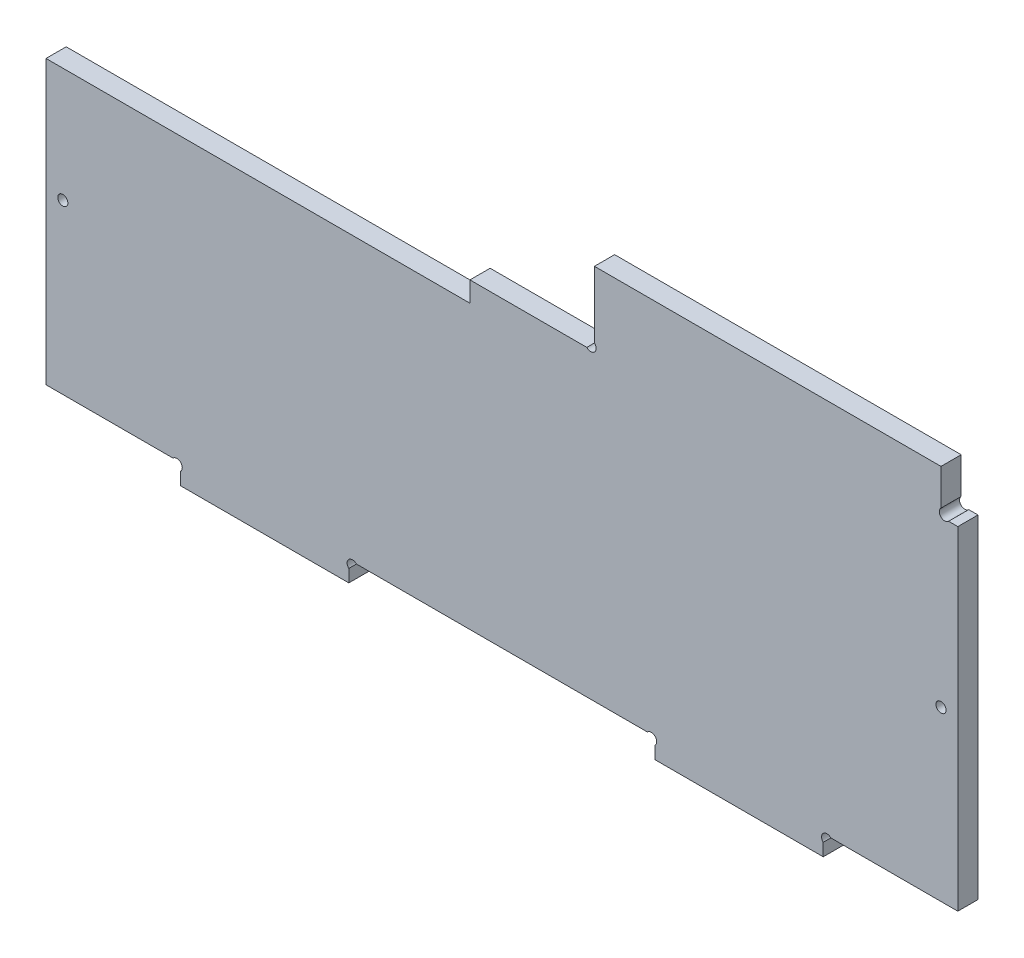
SolidWorks part; units mm, degrees
ref_plane "Face" through (0, 0, 0) normal (0, 0, 1) x (1, 0, 0)
ref_plane "Dessus" through (0, 0, 0) normal (0, 1, 0) x (1, 0, 0)
ref_plane "Droite" through (0, 0, 0) normal (1, 0, 0) x (0, 0, -1)
sketch "Esquisse1" plane through (0, 0, 0) normal (0, 0, 1) x (1, 0, 0)
  line L0 (271, 105) -> (266, 105)
  line L1 (0, 0) -> (271, 0)
  line L2 (0, 0) -> (0, 90)
  line L3 (266, 105) -> (266, 118)
  line L4 (271, 0) -> (271, 105)
  line L5 (266, 118) -> (163, 118)
  line L6 (163, 118) -> (163, 96)
  line L7 (126, 90) -> (0, 90)
  line L8 (163, 96) -> (126, 96)
  line L9 (126, 96) -> (126, 90)
  dimension "D1" = 271
  dimension "D2" = 90
  dimension "D3" = 105
  dimension "D4" = 103
  dimension "D5" = 13
  dimension "D6" = 5
  dimension "D7" = 37
  dimension "D8" = 6
extrude "Extrusion1" add sketch "Esquisse1" along normal blind 6
sketch "Esquisse2" plane through (0, 0, 6) normal (0, 0, 1) x (1, 0, 0)
  line L0 (0, 0) -> (271, 0) construction
  line L1 (271, 0) -> (231, 0)
  line L2 (271, 0) -> (271, 6)
  line L3 (271, 6) -> (231, 6)
  line L4 (231, 0) -> (231, 6)
  line L5 (0, 0) -> (40, 0)
  line L6 (0, 0) -> (0, 6)
  line L7 (0, 6) -> (40, 6)
  line L8 (40, 0) -> (40, 6)
  line L9 (90, 6) -> (181, 6)
  line L10 (90, 6) -> (90, 0)
  line L11 (90, 0) -> (181, 0)
  line L12 (181, 6) -> (181, 0)
  dimension "D1" = 6
  dimension "D2" = 6
  dimension "D3" = 6
  dimension "D4" = 40
  dimension "D5" = 40
  dimension "D6" = 50
  dimension "D7" = 50
extrude "Enlèv. mat.-Extru.1" cut sketch "Esquisse2" against normal up to vertex (6 mm away)
sketch "Esquisse3" plane through (0, 0, 6) normal (0, 0, 1) x (1, 0, 0)
  line L0 (40, 6) -> (0, 6) construction
  line L1 (40, 0) -> (40, 6) construction
  line L2 (181, 6) -> (90, 6) construction
  line L3 (90, 6) -> (90, 0) construction
  line L4 (181, 0) -> (181, 6) construction
  line L5 (271, 6) -> (231, 6) construction
  line L6 (231, 6) -> (231, 0) construction
  line L11 (266, 105) -> (266, 118) construction
  line L12 (271, 105) -> (266, 105) construction
  line L13 (163, 118) -> (163, 96) construction
  line L14 (163, 96) -> (126, 96) construction
  circle A0 centre (38.9, 4.9) radius 1.6
  circle A1 centre (91.1, 4.9) radius 1.6
  circle A2 centre (179.9, 4.9) radius 1.6
  circle A3 centre (232.1, 4.9) radius 1.6
  circle A4 centre (267.1, 106.1) radius 1.6
  circle A5 centre (161.9, 97.1) radius 1.6
  dimension "D1" = 1.1
  dimension "D3" = 1.1
  dimension "D5" = 1.1
  dimension "D7" = 1.1
  dimension "D9" = 1.1
  dimension "D11" = 1.1
  dimension "D2" = 1.1
  dimension "D4" = 1.1
  dimension "D6" = 1.1
  dimension "D8" = 1.1
  dimension "D10" = 1.1
  dimension "D12" = 1.1
extrude "Enlèv. mat.-Extru.2" cut sketch "Esquisse3" against normal up to vertex (6 mm away)
sketch "Esquisse4" plane through (0, 0, 6) normal (0, 0, 1) x (1, 0, 0)
  line L0 (271, 6) -> (271, 105) construction
  line L1 (271, 6) -> (233.2619, 6) construction
  line L3 (0, 90) -> (0, 6) construction
  line L4 (37.7381, 6) -> (0, 6) construction
  circle A0 centre (266, 56) radius 1.5
  circle A2 centre (5, 56) radius 1.5
  dimension "D1" = 5
  dimension "D2" = 50
  dimension "D5" = 5
  dimension "D6" = 50
extrude "Enlèv. mat.-Extru.3" cut sketch "Esquisse4" against normal up to vertex (6 mm away)
